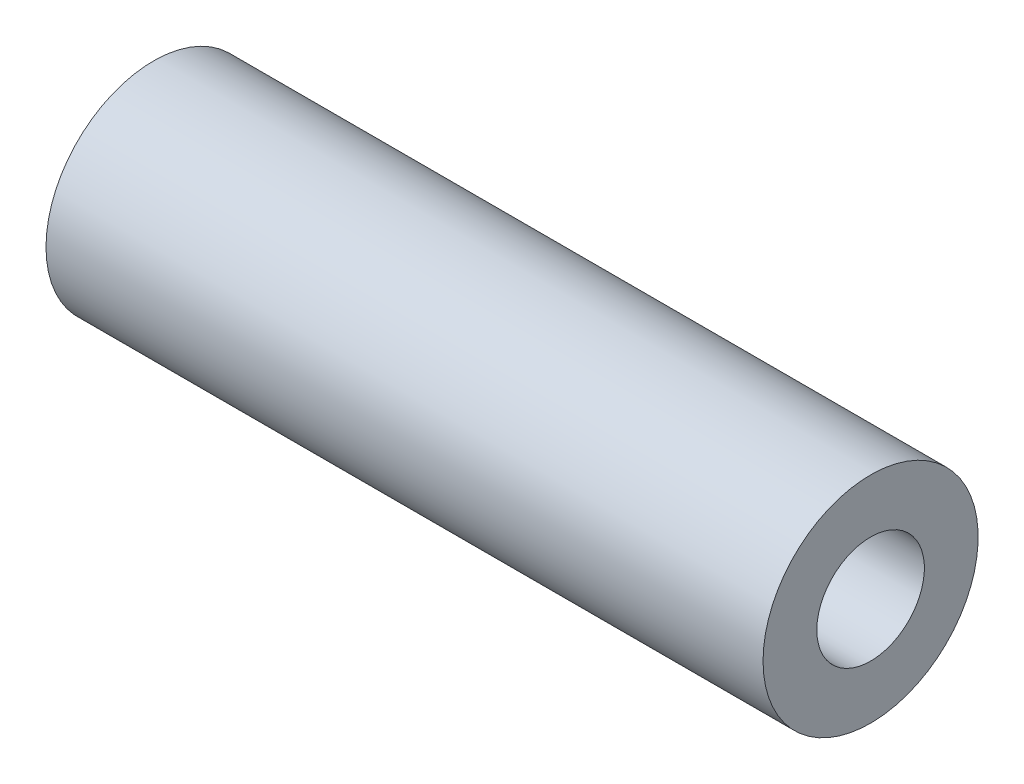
SolidWorks part; units mm, degrees
ref_plane "Front Plane" through (0, 0, 0) normal (0, 0, 1) x (1, 0, 0)
ref_plane "Top Plane" through (0, 0, 0) normal (0, 1, 0) x (1, 0, 0)
ref_plane "Right Plane" through (0, 0, 0) normal (1, 0, 0) x (0, 0, -1)
sketch "Sketch1" plane through (0, 0, 0) normal (0, 0, 1) x (1, 0, 0)
  line L0 (0, 73.8091) -> (0, -74.0919) construction
  line L1 (-115.5155, 0) -> (132.1737, 0) construction
  line L3 (-63.5, 19.05) -> (63.5, 19.05)
  line L4 (-63.5, 19.05) -> (-63.5, 9.525)
  line L5 (-63.5, 9.525) -> (63.5, 9.525)
  line L6 (63.5, 19.05) -> (63.5, 9.525)
  dimension "D1" = 127
  dimension "D2" = 9.525
  dimension "D3" = 9.525
revolve "Revolve1" add sketch "Sketch1" angle 360 about L1
sketch3d "3DSketch2"
  point P0 (440.5397, 73.7377, 293.7227)
